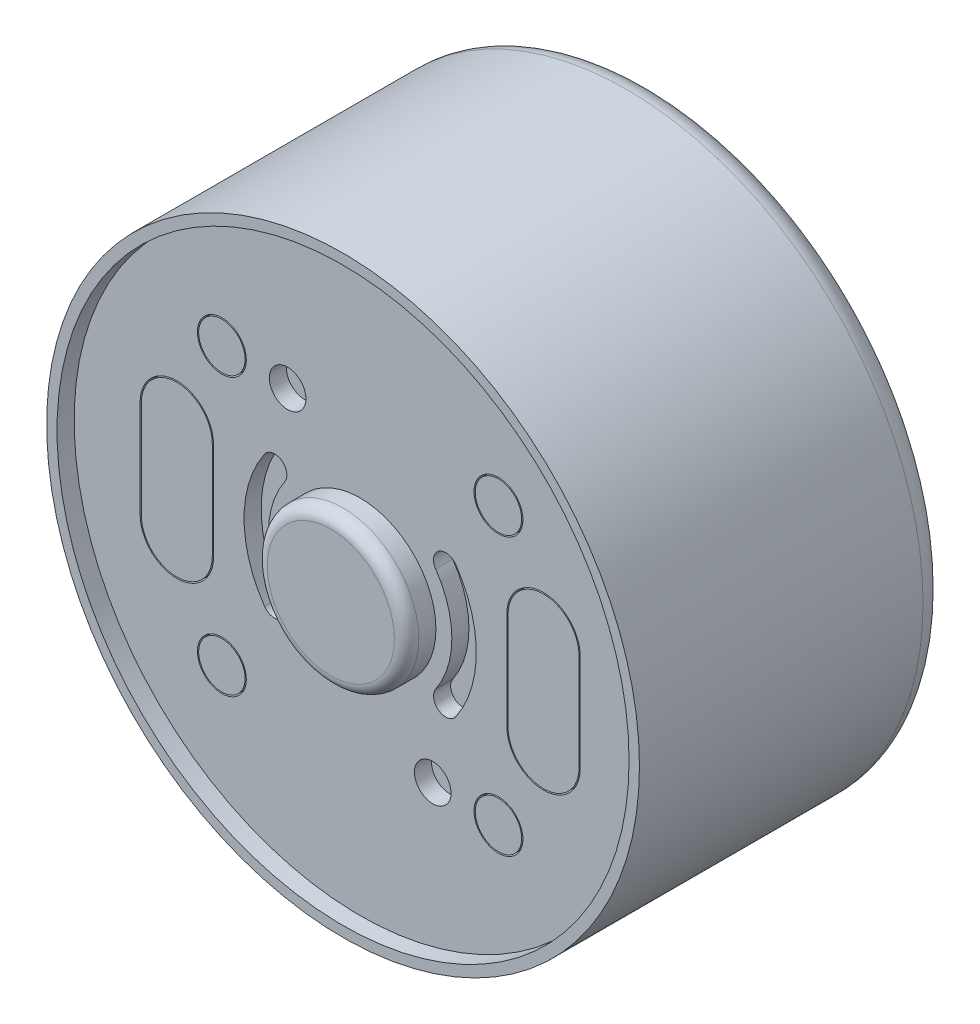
SolidWorks part; units mm, degrees
ref_plane "Plan de face" through (0, 0, 0) normal (0, 0, 1) x (1, 0, 0)
ref_plane "Plan de dessus" through (0, 0, 0) normal (0, 1, 0) x (1, 0, 0)
ref_plane "Plan de droite" through (0, 0, 0) normal (1, 0, 0) x (0, 0, -1)
sketch "Esquisse1" plane through (0, 0, 0) normal (0, 0, 1) x (1, 0, 0)
  circle A0 centre (0, 0) radius 12.125
  dimension "D1" = 24.25
extrude "Extrusion1" add sketch "Esquisse1" against normal blind 12.6
sketch "Esquisse2" plane through (0, 0, -12.6) normal (0, 0, -1) x (-1, 0, 0)
  circle A0 centre (0, 0) radius 1
  dimension "D1" = 2
extrude "Extrusion2" add sketch "Esquisse2" along normal blind 7
fillet "Congé1" radius 1 1 edges at (12.125, 0, -12.6)
fillet "Congé2" radius 0.2 1 edges at (-1, 0, -19.6)
sketch "Esquisse3" plane through (0, 0, -12.6) normal (0, 0, -1) x (-1, 0, 0)
  circle A0 centre (0, 0) radius 3.25
  dimension "D1" = 6.5
extrude "Extrusion3" add sketch "Esquisse3" along normal blind 0.5
sketch "Esquisse4" plane through (0, 0, -13.1) normal (0, 0, -1) x (-1, 0, 0)
  circle A0 centre (0, 0) radius 2.5
  circle A1 centre (0, 0) radius 2.45
  dimension "D1" = 5
  dimension "D2" = 0.05
extrude "Enlèv. mat.-Extru.1" cut sketch "Esquisse4" against normal blind 0.1
sketch "Esquisse5" plane through (0, 0, 0) normal (0, 0, 1) x (1, 0, 0)
  circle A0 centre (0, 0) radius 11.7
  dimension "D1" = 23.4
extrude "Enlèv. mat.-Extru.2" cut sketch "Esquisse5" against normal blind 0.7
sketch "Esquisse6" plane through (0, 0, -0.7) normal (0, 0, 1) x (1, 0, 0)
  line L0 (-3.5, 2.4109) -> (3.5, 2.4109) construction
  line L1 (0, 0) -> (0, 2.4109) construction
  line L2 (0, 0) -> (0, -2.4109) construction
  line L3 (-3.5, -2.4109) -> (3.5, -2.4109) construction
  line L4 (-9, 2) -> (-9, -2)
  line L5 (6, 2) -> (6, -2)
  line L6 (-6, 2) -> (-6, -2)
  line L7 (9, 2) -> (9, -2)
  line L8 (-7.5, -2) -> (-7.5, 2) construction
  line L9 (-7.5, 2) -> (-7.5, 0) construction
  line L10 (-7.5, 0) -> (0, 0) construction
  line L11 (-8.95, 2) -> (-8.95, -2)
  line L12 (-6.05, 2) -> (-6.05, -2)
  line L13 (6.05, 2) -> (6.05, -2)
  line L14 (8.95, 2) -> (8.95, -2)
  line L15 (0, 0) -> (-2.9686, 5.5) construction
  line L16 (0, 0) -> (2.9686, -5.5) construction
  line L17 (0, 0) -> (-5.6569, 5.6569) construction
  line L18 (0, 0) -> (5.6569, -5.6569) construction
  line L19 (0, 0) -> (-5.6569, -5.6569) construction
  line L20 (0, 0) -> (5.6569, 5.6569) construction
  arc A0 (3.9118, -2.6945) -> (3.9118, 2.6945) centre (0, 0) ccw
  arc A1 (3.0882, -2.1273) -> (3.0882, 2.1273) centre (0, 0) ccw
  circle A2 centre (0, 0) radius 4.25 construction
  arc A3 (-3.0882, 2.1273) -> (-3.9118, 2.6945) centre (-3.5, 2.4109) ccw
  arc A4 (-3.9118, -2.6945) -> (-3.0882, -2.1273) centre (-3.5, -2.4109) ccw
  arc A5 (3.0882, -2.1273) -> (3.9118, -2.6945) centre (3.5, -2.4109) ccw
  arc A6 (3.9118, 2.6945) -> (3.0882, 2.1273) centre (3.5, 2.4109) ccw
  arc A7 (-3.0882, 2.1273) -> (-3.0882, -2.1273) centre (0, 0) ccw
  arc A8 (-3.9118, 2.6945) -> (-3.9118, -2.6945) centre (0, 0) ccw
  arc A9 (-6, 2) -> (-9, 2) centre (-7.5, 2) ccw
  arc A10 (-9, -2) -> (-6, -2) centre (-7.5, -2) ccw
  arc A11 (9, -2) -> (6, -2) centre (7.5, -2) cw
  arc A12 (6, 2) -> (9, 2) centre (7.5, 2) cw
  arc A13 (-8.95, -2) -> (-6.05, -2) centre (-7.5, -2) ccw
  arc A14 (-6.05, 2) -> (-8.95, 2) centre (-7.5, 2) ccw
  arc A15 (8.95, -2) -> (6.05, -2) centre (7.5, -2) cw
  arc A16 (6.05, 2) -> (8.95, 2) centre (7.5, 2) cw
  circle A17 centre (0, 0) radius 6.25 construction
  circle A18 centre (-2.9686, 5.5) radius 0.75
  circle A19 centre (2.9686, -5.5) radius 0.75
  circle A20 centre (0, 0) radius 8 construction
  circle A21 centre (-5.6569, 5.6569) radius 1
  circle A22 centre (-5.6569, -5.6569) radius 1
  circle A23 centre (5.6569, -5.6569) radius 1
  circle A24 centre (5.6569, 5.6569) radius 1
  circle A25 centre (-5.6569, 5.6569) radius 0.95
  circle A26 centre (-5.6569, -5.6569) radius 0.95
  circle A27 centre (5.6569, -5.6569) radius 0.95
  circle A28 centre (5.6569, 5.6569) radius 0.95
  dimension "D1" = 7.5
  dimension "D2" = 9.5
  dimension "D4" = 8.5
  dimension "D9" = 12.5
  dimension "D11" = 1.5
  dimension "D12" = 16
  dimension "D16" = 2
  dimension "D3" = 7
  dimension "D5" = 3
  dimension "D6" = 12
  dimension "D7" = 4
  dimension "D10" = 11
  dimension "D13" = 45
  dimension "D14" = 45
  dimension "D8" = 0.05
  dimension "D15" = 0.05
extrude "Enlèv. mat.-Extru.3" cut sketch "Esquisse6" against normal blind 0.7
sketch "Esquisse7" plane through (0, 0, -0.7) normal (0, 0, 1) x (1, 0, 0)
  circle A0 centre (0, 0) radius 3.1
  dimension "D1" = 6.2
extrude "Extrusion4" add sketch "Esquisse7" along normal blind 1.2
fillet "Congé3" radius 0.5 1 edges at (3.1, 0, 0.5)
